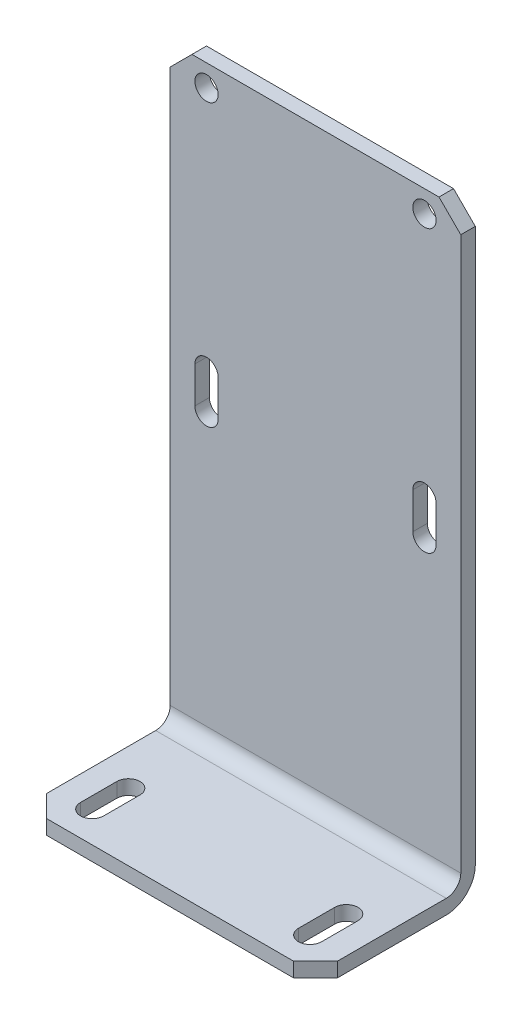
SolidWorks part; units mm, degrees
ref_plane "Face" through (0, 0, 0) normal (0, 0, 1) x (1, 0, 0)
ref_plane "Dessus" through (0, 0, 0) normal (0, 1, 0) x (1, 0, 0)
ref_plane "Droite" through (0, 0, 0) normal (1, 0, 0) x (0, 0, -1)
sketch "Esquisse3" plane through (0, 0, 0) normal (0, 0, 1) x (1, 0, 0)
  line L1 (0, 0) -> (40, 0)
  line L2 (0, 0) -> (0, 83.1)
  line L3 (0, 83.1) -> (40, 83.1)
  line L4 (40, 0) -> (40, 83.1)
  dimension "D1" = 40
  dimension "D2" = 83.1
extrude "Base-Extrusion" add sketch "Esquisse3" along normal blind 2
sketch "Esquisse4" plane through (0, 0, 2) normal (0, 0, 1) x (1, 0, 0)
  line L0 (0, 83.1) -> (0, 0) construction
  line L1 (40, 0) -> (0, 0)
  line L2 (40, 0) -> (40, 2)
  line L3 (40, 2) -> (0, 2)
  line L4 (0, 0) -> (0, 2)
  dimension "D1" = 2
extrude "Boss.-Extru.1" add sketch "Esquisse4" along normal blind 20
fillet "Congé1" radius 2
fillet "Congé2" radius 4
sketch "Esquisse5" plane through (0, 0, 2) normal (0, 0, 1) x (1, 0, 0)
  line L0 (40, 83.1) -> (0, 83.1) construction
  line L1 (0, 83.1) -> (0, 4) construction
  line L2 (20, 91.029) -> (20, 29.601) construction
  line L3 (40, 4) -> (40, 83.1) construction
  circle A0 centre (5, 80.1) radius 1.6
  dimension "D1" = 3.2
  dimension "D2" = 3
  dimension "D3" = 5
  dimension "D4" = 20
extrude "Enlèv. mat.-Extru.1" cut sketch "Esquisse5" against normal through all
ref_plane "Plan1" through (20, 0, 0) normal (1, 0, 0) x (0, 0, -1)
mirror "Symétrie1" about plane through (20, 0, 0) normal (1, 0, 0)
sketch "Esquisse6" plane through (0, 0, 2) normal (0, 0, 1) x (1, 0, 0)
  line L0 (3.4, 46.4) -> (3.4, 41.4)
  line L1 (6.6, 46.4) -> (6.6, 41.4)
  line L3 (0, 83.1) -> (0, 4) construction
  arc A0 (6.6, 46.4) -> (3.4, 46.4) centre (5, 46.4) ccw
  arc A1 (6.6, 41.4) -> (3.4, 41.4) centre (5, 41.4) cw
  dimension "D2" = 1.6
  dimension "D1" = 5
  dimension "D3" = 33.7
  dimension "D4" = 5
extrude "Enlèv. mat.-Extru.2" cut sketch "Esquisse6" against normal through all
mirror "Symétrie2" about plane through (20, 0, 0) normal (1, 0, 0)
sketch "Esquisse7" plane through (0, 2, 0) normal (0, 1, 0) x (-1, 0, 0)
  line L0 (-3.4, 17.75) -> (-3.4, 12.75)
  line L1 (-3.4, 0) -> (-3.4, 2) construction
  line L2 (-6.6, 17.75) -> (-6.6, 12.75)
  line L3 (-40, 22) -> (0, 22) construction
  arc A0 (-3.4, 17.75) -> (-6.6, 17.75) centre (-5, 17.75) ccw
  arc A1 (-6.6, 12.75) -> (-3.4, 12.75) centre (-5, 12.75) ccw
  dimension "D2" = 1.6
  dimension "D1" = 5
  dimension "D3" = 4.25
extrude "Enlèv. mat.-Extru.3" cut sketch "Esquisse7" against normal through all
mirror "Symétrie3" about plane through (20, 0, 0) normal (1, 0, 0)
chamfer "Chanfrein1" distance 3 angle 45
